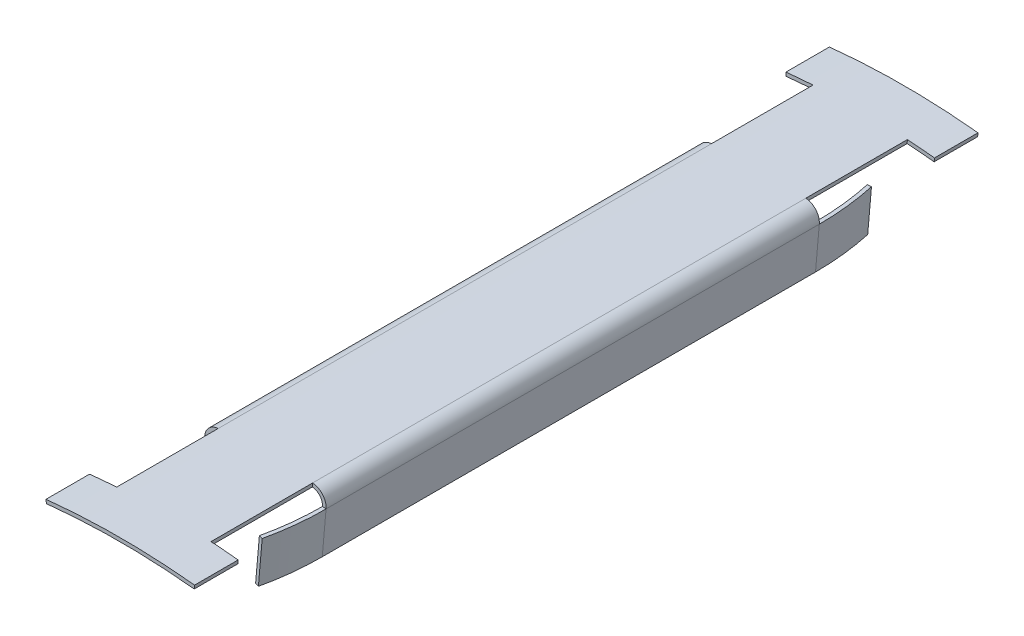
SolidWorks part; units mm, degrees
ref_plane "Plan de face" through (0, 0, 0) normal (0, 0, 1) x (1, 0, 0)
ref_plane "Plan de dessus" through (0, 0, 0) normal (0, 1, 0) x (1, 0, 0)
ref_plane "Plan de droite" through (0, 0, 0) normal (1, 0, 0) x (0, 0, -1)
sketch "Esquisse1" plane through (0, 0, 0) normal (0, 0, 1) x (1, 0, 0)
  line L0 (0, 0) -> (0, 68.6027) construction
  line L1 (0, 0) -> (-6.6602, 76.1263) construction
  line L2 (0, 0) -> (6.4545, 73.7754) construction
  line L3 (-3.9335, 47.8288) -> (-3.672, 44.84)
  line L4 (-3.672, 44.84) -> (-3.9211, 44.8182)
  line L5 (-3.9211, 44.8182) -> (-4.1826, 47.807)
  line L9 (0, 48.75) -> (0, 49)
  arc A0 (0, 49) -> (-3.2528, 48.8919) centre (0, 0) ccw
  arc A1 (0, 48.75) -> (-3.2362, 48.6425) centre (0, 0) ccw
  arc A2 (-3.2362, 48.6425) -> (-3.9335, 47.8288) centre (-3.1864, 47.8941) ccw
  arc A3 (-4.1826, 47.807) -> (-3.2528, 48.8919) centre (-3.1864, 47.8941) cw
  dimension "D1" = 98
  dimension "D3" = 97.5
  dimension "D6" = 4
  dimension "D5" = 1
  dimension "D2" = 5
  dimension "D4" = 5
extrude "Extrusion1" add sketch "Esquisse1" along normal blind 34
sketch "Esquisse2" plane through (-3.9211, 44.8182, 0) normal (0.0872, -0.9962, 0) x (0.9962, 0.0872, 0)
  line L0 (0.25, 34) -> (0.25, 0) construction
  line L1 (0, 34) -> (0.25, 34)
  line L2 (0.4041, 38) -> (0.649, 37.95)
  line L3 (0, 17) -> (3.9758, 17) construction
  line L4 (0, 34) -> (0, 0) construction
  line L5 (0.4041, -4) -> (0.649, -3.95)
  line L6 (0, 0) -> (0.25, 0)
  arc A0 (0.4041, 38) -> (0, 34) centre (20, 34) ccw
  arc A1 (0.649, 37.95) -> (0.25, 34) centre (20, 34) ccw
  arc A2 (0.649, -3.95) -> (0.25, 0) centre (20, 0) cw
  arc A3 (0.4041, -4) -> (0, 0) centre (20, 0) cw
  dimension "D1" = 20
  dimension "D2" = 4
extrude "Extrusion2" add sketch "Esquisse2" against normal blind 3
sketch "Esquisse3" plane through (0, 0, 0) normal (0, 0, -1) x (-1, 0, 0)
  line L0 (3.2362, 48.6425) -> (3.2528, 48.8919)
  line L4 (3.9335, 47.8288) -> (3.9335, 47.8285)
  line L5 (3.9335, 47.8285) -> (4.1825, 47.8068)
  line L6 (4.1825, 47.8068) -> (4.1826, 47.807)
  line L7 (0, 49) -> (0, 48.75)
  line L11 (0, 49) -> (0, 48.75)
  arc A4 (4.1826, 47.807) -> (3.2528, 48.8919) centre (3.1864, 47.8941) ccw
  arc A5 (3.2528, 48.8919) -> (0, 49) centre (0, 0) ccw
  arc A6 (3.2362, 48.6425) -> (0, 48.75) centre (0, 0) ccw
  arc A7 (3.9335, 47.8288) -> (3.2362, 48.6425) centre (3.1864, 47.8941) ccw
  arc A9 (3.2528, 48.8919) -> (0, 49) centre (0, 0) ccw
  arc A10 (3.2362, 48.6425) -> (0, 48.75) centre (0, 0) ccw
  dimension "D1" = 0
extrude "Extrusion3" add sketch "Esquisse3" along normal blind 10
sketch "Esquisse4" plane through (0, 0, 34) normal (0, 0, 1) x (1, 0, 0)
  line L0 (-3.2362, 48.6425) -> (-3.2528, 48.8919)
  line L4 (-4.1826, 47.807) -> (-4.1825, 47.8068)
  line L5 (-4.1825, 47.8068) -> (-3.9335, 47.8285)
  line L6 (-3.9335, 47.8285) -> (-3.9335, 47.8288)
  line L7 (0, 48.75) -> (0, 49)
  line L11 (0, 48.75) -> (0, 49)
  arc A4 (-3.2362, 48.6425) -> (-3.9335, 47.8288) centre (-3.1864, 47.8941) ccw
  arc A5 (0, 48.75) -> (-3.2362, 48.6425) centre (0, 0) ccw
  arc A6 (0, 49) -> (-3.2528, 48.8919) centre (0, 0) ccw
  arc A7 (-3.2528, 48.8919) -> (-4.1826, 47.807) centre (-3.1864, 47.8941) ccw
  arc A9 (0, 48.75) -> (-3.2362, 48.6425) centre (0, 0) ccw
  arc A10 (0, 49) -> (-3.2528, 48.8919) centre (0, 0) ccw
  dimension "D1" = 0
extrude "Extrusion4" add sketch "Esquisse4" along normal blind 10
sketch "Esquisse5" plane through (0, 0, 44) normal (0, 0, 1) x (1, 0, 0)
  line L0 (-5.1219, 48.7316) -> (-5.0958, 48.4829)
  line L1 (0, 49) -> (0, 48.75)
  arc A0 (0, 49) -> (-5.1219, 48.7316) centre (0, 0) ccw
  arc A1 (0, 49) -> (-3.2528, 48.8919) centre (0, 0) ccw construction
  arc A2 (0, 48.75) -> (-5.0958, 48.4829) centre (0, 0) ccw
  arc A3 (0, 48.75) -> (-3.2362, 48.6425) centre (0, 0) ccw construction
  dimension "D1" = 6
extrude "Extrusion5" add sketch "Esquisse5" against normal blind 3
sketch "Esquisse6" plane through (0, 0, -10) normal (0, 0, -1) x (-1, 0, 0)
  line L2 (0, 49) -> (0, 48.75)
  line L3 (5.0958, 48.4829) -> (5.1219, 48.7316)
  line L4 (0, 49) -> (0, 48.75)
  line L5 (5.0958, 48.4829) -> (5.1219, 48.7316)
  arc A2 (5.0958, 48.4829) -> (0, 48.75) centre (0, 0) ccw
  arc A3 (5.1219, 48.7316) -> (0, 49) centre (0, 0) ccw
  arc A4 (5.0958, 48.4829) -> (0, 48.75) centre (0, 0) ccw
  arc A5 (5.1219, 48.7316) -> (0, 49) centre (0, 0) ccw
  dimension "D1" = 0
extrude "Extrusion6" add sketch "Esquisse6" against normal blind 3
mirror "Symétrie1" about plane through (0, 48.75, 34) normal (-1, 0, 0) of "Extrusion6", "Extrusion5", "Extrusion1", "Extrusion2", "Extrusion3", "Extrusion4"
